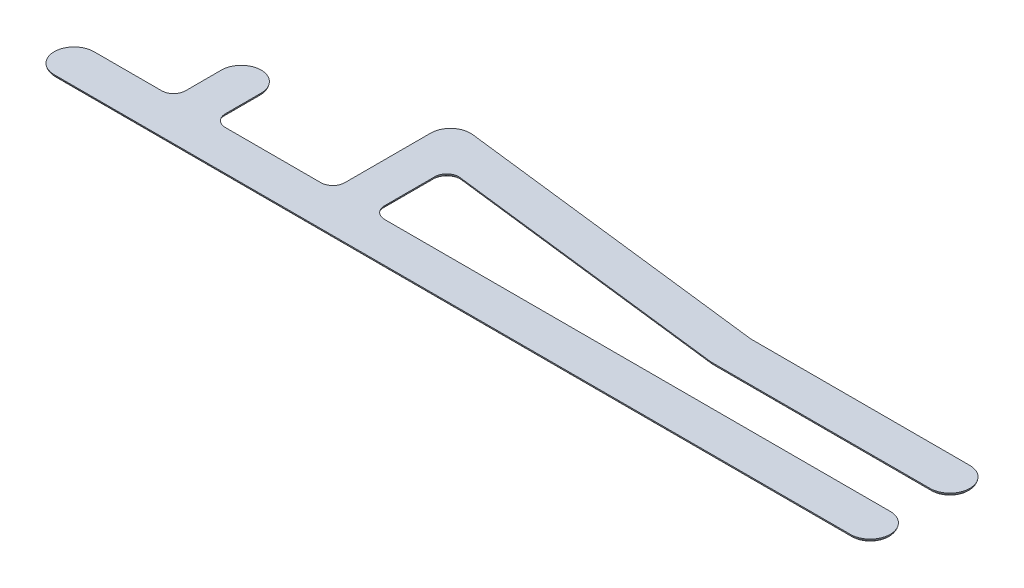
SolidWorks part; units mm, degrees
ref_plane "Ebene vorne" through (0, 0, 0) normal (0, 0, 1) x (1, 0, 0)
ref_plane "Ebene oben" through (0, 0, 0) normal (0, 1, 0) x (1, 0, 0)
ref_plane "Ebene rechts" through (0, 0, 0) normal (1, 0, 0) x (0, 0, -1)
sketch "Skizze1" plane through (0, 0, 0) normal (0, 1, 0) x (-1, 0, 0)
  line L0 (-200, 5) -> (0, 5)
  line L1 (0, -5) -> (-17, -5)
  line L2 (-20, -8) -> (-20, -17)
  line L3 (-30, -17) -> (-30, -8)
  line L4 (-33, -5) -> (-57, -5)
  line L5 (-60, -8) -> (-60, -29.56)
  line L6 (-200, -15) -> (-145.2988, -15)
  line L7 (-144.7033, -15.0356) -> (-73.3573, -23.5934)
  line L8 (-70, -20.6148) -> (-70, -8)
  line L9 (-73, -5) -> (-200, -5)
  line L10 (-200, 0) -> (-200, -20) construction
  line L11 (-200, -25) -> (-145.2988, -25)
  line L12 (-144.7033, -25.0356) -> (-65.5955, -34.5244)
  line L13 (-145, -15) -> (-145, -25) construction
  arc A0 (0, 5) -> (0, -5) centre (0, 0) cw
  arc A1 (-20, -17) -> (-30, -17) centre (-25, -17) cw
  arc A2 (-200, -25) -> (-200, -15) centre (-200, -20) cw
  arc A3 (-200, -5) -> (-200, 5) centre (-200, 0) cw
  arc A4 (-60, -29.56) -> (-65.5955, -34.5244) centre (-65, -29.56) cw
  arc A5 (-144.7033, -15.0356) -> (-145.2988, -15) centre (-145.2988, -20) ccw
  arc A6 (-144.7033, -25.0356) -> (-145.2988, -25) centre (-145.2988, -30) ccw
  arc A7 (-17, -5) -> (-20, -8) centre (-17, -8) ccw
  arc A8 (-30, -8) -> (-33, -5) centre (-33, -8) ccw
  arc A9 (-57, -5) -> (-60, -8) centre (-57, -8) ccw
  arc A10 (-73.3573, -23.5934) -> (-70, -20.6148) centre (-73, -20.6148) ccw
  arc A11 (-70, -8) -> (-73, -5) centre (-73, -8) ccw
  dimension "D2" = 5
  dimension "D7" = 5
  dimension "D9" = 5
  dimension "D16" = 5
  dimension "D17" = 5
  dimension "D18" = 3
  dimension "D1" = 10
  dimension "D3" = 12
  dimension "D4" = 20
  dimension "D5" = 30
  dimension "D6" = 10
  dimension "D8" = 10
  dimension "D10" = 34.56
  dimension "D11" = 30
  dimension "D12" = 200
  dimension "D14" = 55
extrude "Aufsatz-Linear austragen1" add sketch "Skizze1" against normal blind 1
fillet "Verrundung1" radius 1.2 24 edges at (59.1213, -1, -5.8787) (60, -1, -18.78) (61.6817, -1, -33.3001) (105.1494, -1, -29.78) (145.0005, -1, -25.0089) (172.6494, -1, -25) (205, -1, -20) (172.6494, -1, -15) (145.0005, -1, -15.0089) (109.0303, -1, -19.3145) (71.009, -1, -22.8588) (70, -1, -14.3074) (70.8787, -1, -5.8787) (136.5, -1, -5) (205, -1, 0) (100, -1, 5) (-5, -1, 0) (8.5, -1, -5) (19.1213, -1, -5.8787) (20, -1, -12.5) (25, -1, -22) (30, -1, -12.5) (30.8787, -1, -5.8787) (45, -1, -5)
sketch "Positionierungsskizze" plane through (0, 0, 0) normal (0, 1, 0) x (1, 0, 0)
  line L0 (0, 0) -> (0, -10.8757) construction
  line L1 (0, 0) -> (34.2636, 0) construction
